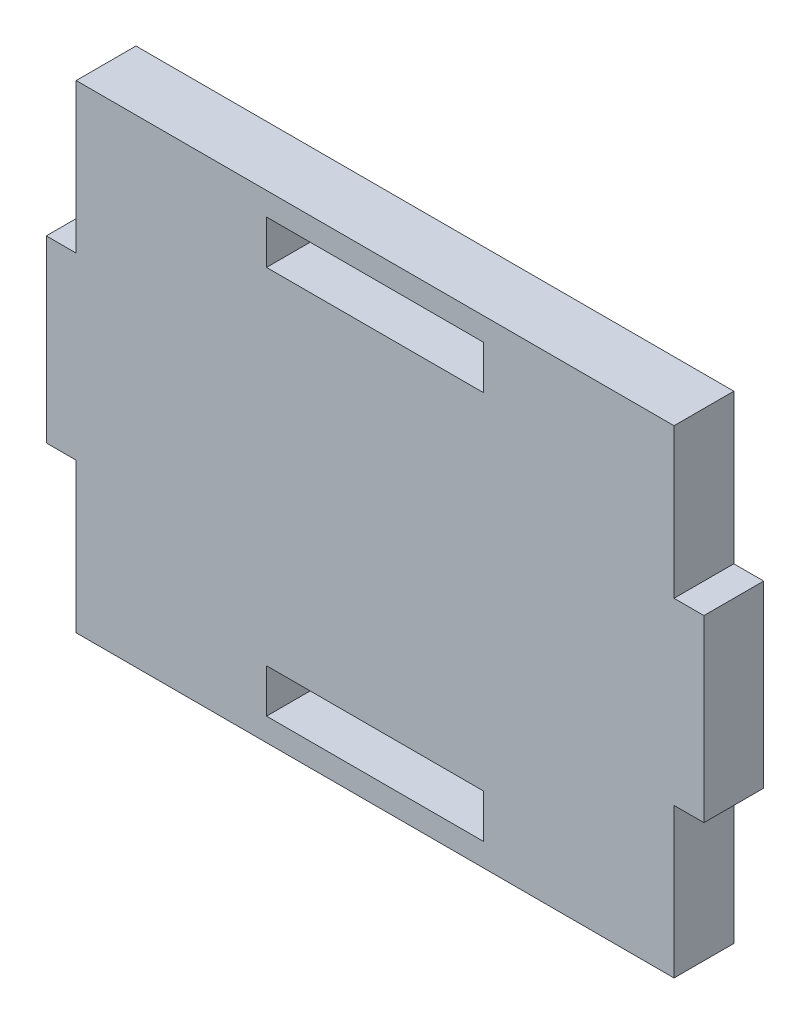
SolidWorks part; units mm, degrees
ref_plane "Front Plane" through (0, 0, 0) normal (0, 0, 1) x (1, 0, 0)
ref_plane "Top Plane" through (0, 0, 0) normal (0, 1, 0) x (1, 0, 0)
ref_plane "Right Plane" through (0, 0, 0) normal (1, 0, 0) x (0, 0, -1)
sketch "Sketch1" plane through (0, 0, 0) normal (0, 0, 1) x (1, 0, 0)
  line L0 (0, 59.917) -> (0, -53.278) construction
  line L1 (-50, -40) -> (50, -40)
  line L2 (-50, -40) -> (-50, -15)
  line L3 (-50, 40) -> (50, 40)
  line L4 (50, -40) -> (50, -15)
  line L5 (-50, -40) -> (50, 40) construction
  line L6 (-50, 40) -> (50, -40) construction
  line L7 (-71.1353, 0) -> (91.5203, 0) construction
  line L8 (-71.1353, 32.5) -> (75.2548, 32.5) construction
  line L9 (-50, 15) -> (-50, 40)
  line L10 (-18.1593, 28.8485) -> (18.1593, 28.8485)
  line L11 (-18.1593, 28.8485) -> (-18.1593, 36.1515)
  line L12 (-18.1593, 36.1515) -> (18.1593, 36.1515)
  line L13 (18.1593, 28.8485) -> (18.1593, 36.1515)
  line L14 (-18.1593, 28.8485) -> (18.1593, 36.1515) construction
  line L15 (-18.1593, 36.1515) -> (18.1593, 28.8485) construction
  line L16 (-55, -15) -> (-50, -15)
  line L17 (-55, -15) -> (-55, 15)
  line L18 (-55, 15) -> (-50, 15)
  line L19 (18.1593, -28.8485) -> (18.1593, -36.1515)
  line L20 (-55, -15) -> (-45, 15) construction
  line L21 (-55, 15) -> (-45, -15) construction
  line L22 (-18.1593, -28.8485) -> (18.1593, -28.8485)
  line L23 (-18.1593, -28.8485) -> (-18.1593, -36.1515)
  line L24 (-18.1593, -36.1515) -> (18.1593, -36.1515)
  line L25 (55, -15) -> (50, -15)
  line L26 (55, 15) -> (50, 15)
  line L27 (55, -15) -> (55, 15)
  line L28 (50, 15) -> (50, 40)
  point P0 (0, 0)
  point P12 (0, 32.5)
  point P17 (-50, 0)
  dimension "D1" = 80
  dimension "D2" = 100
  dimension "D3" = 32.5
  dimension "D4" = 30
  dimension "D5" = 10
  dimension "D6" = 5
extrude "Boss-Extrude1" add sketch "Sketch1" along normal blind 10
